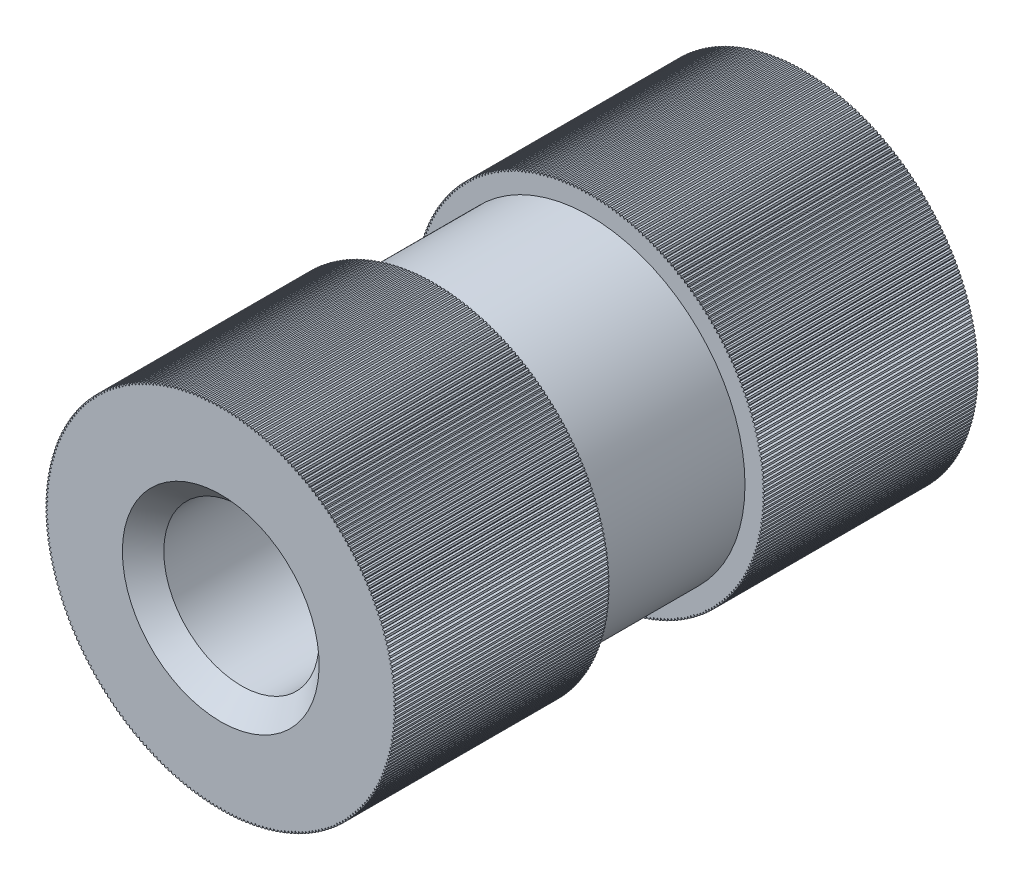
SolidWorks part; units mm, degrees
ref_plane "Front" through (0, 0, 0) normal (0, 0, 1) x (1, 0, 0)
ref_plane "Top" through (0, 0, 0) normal (0, 1, 0) x (1, 0, 0)
ref_plane "Right" through (0, 0, 0) normal (1, 0, 0) x (0, 0, -1)
sketch "Sketch1" plane through (0, -9.768, 0.768) normal (1, 0, 0) x (0, 1, 0)
  line L0 (9.768, 37.6566) -> (9.768, -48.1926) construction
  line L1 (9.768, -30.768) -> (18.768, -30.768)
  line L2 (18.768, -30.768) -> (18.768, -19.768)
  line L3 (18.768, -19.768) -> (17.768, -19.768)
  line L4 (17.768, -19.768) -> (17.768, -11.768)
  line L5 (17.768, -11.768) -> (18.768, -11.768)
  line L6 (18.768, -11.768) -> (18.768, -0.768)
  line L7 (18.768, -0.768) -> (9.768, -0.768)
  line L8 (9.768, -0.768) -> (9.768, -30.768)
  dimension "c" = 8
  dimension "m" = 30
  dimension "d1" = 16
  dimension "dk" = 18
revolve "BaseNut" add sketch "Sketch1" angle 360 about L0
sketch "Sketch4" plane through (0, 13.5422, -17.5422) normal (1, 0, 0) x (0, 1, 0)
  line L0 (-13.5422, 20.4056) -> (-13.5422, -14.2367) construction
  line L2 (-13.5422, 17.5422) -> (-9.5422, 17.5422)
  line L3 (-4.5422, 17.5422) -> (-22.5422, 17.5422) construction
  line L5 (-9.5422, 17.5422) -> (-9.5422, -4.5378)
  line L6 (-9.5422, -4.5378) -> (-13.5422, -6.8472)
  line L7 (-13.5422, 17.5422) -> (-13.5422, -6.8472)
  dimension "D1" = 8
  dimension "D2" = 60
  dimension "B" = 22.08
revolve "Cut-Revolve1" cut sketch "Sketch4" angle 360 about L0
sketch "Sketch3" plane through (0, 0, 0) normal (0, 0, 1) x (1, 0, 0)
  line L0 (0, 19.5713) -> (0, 0) construction
  line L1 (0, 9) -> (-0.1, 9) construction
  line L2 (0, 8.9) -> (0.0866, 9.05)
  line L3 (0.0866, 9.05) -> (-0.0866, 9.05)
  line L4 (-0.0866, 9.05) -> (0, 8.9)
  line L5 (0, 8.9) -> (-0.1, 8.9) construction
  line L6 (-0.1, 8.9) -> (-0.1, 9) construction
  circle A0 centre (0, 9) radius 0.1 construction
  circle A2 centre (0, 0) radius 9 construction
  dimension "d3" = 0.1
  dimension "D2" = 0.1
extrude "Cut-Extrude1" cut sketch "Sketch3" against normal through all
pattern_circular "CirPattern1" count 282 over 360 about axis through (0, 0, 0) along (0, 0, 1) of "Cut-Extrude1"
chamfer "Chamfer1" distance 1.0667 angle 45 1 edges at (0, -4, 0)
sketch "Sketch5" plane through (0, 0, 0) normal (0, 1, 0) x (1, 0, 0)
  line L0 (3, 1.5667) -> (4, 1.5667)
  line L1 (4, 1.5667) -> (4.866, 1.0667)
  line L2 (4.866, 1.0667) -> (4, 0.5667)
  line L3 (4, 0.5667) -> (3, 0.5667)
  line L4 (3, 0.5667) -> (3, 1.5667)
  line L5 (0, -1.0312) -> (0, -5.3352) construction
  line L6 (-4, 1.0667) -> (4, 1.0667) construction
  dimension "D1" = 1
  dimension "D2" = 8
revolve "Cut-Revolve10" [suppressed] cut sketch "Sketch5" angle 360 about L5
pattern_linear "LPattern10" [suppressed] count 18 spacing 1.2 along (0, 0, -1)
equation "\"D3@Sketch3\" = \"dk@Sketch1\" / 50"
equation "\"D2@Sketch3\" = \"D3@Sketch3\" / 2"
equation "\"D1@CirPattern1\" = int ( 3.14 / atn ( 2 * \"D3@Sketch3\" / \"dk@Sketch1\" )  ) "
equation "\"B1@ThreadCosmetic1\" = \"B@Sketch4\""
equation "\"D1@CirPattern1\" =  int( \"dk@Sketch1\" * PI / 0.5 + 1  )"
equation "\"D1@Chamfer1\" = \"d1@Sketch1\" / 15"
equation "\"D2@Sketch5\" = \"D1@Sketch4\""
equation "\"D1@Sketch5\" = (  \"D2@ThreadCosmetic1\" - \"D1@Sketch4\" )  / 2"
equation "\"D3@LPattern10\" = \"D1@Sketch5\" * 1.2"
equation "\"D1@LPattern10\" = \"B1@ThreadCosmetic1\"  / \"D3@LPattern10\""
